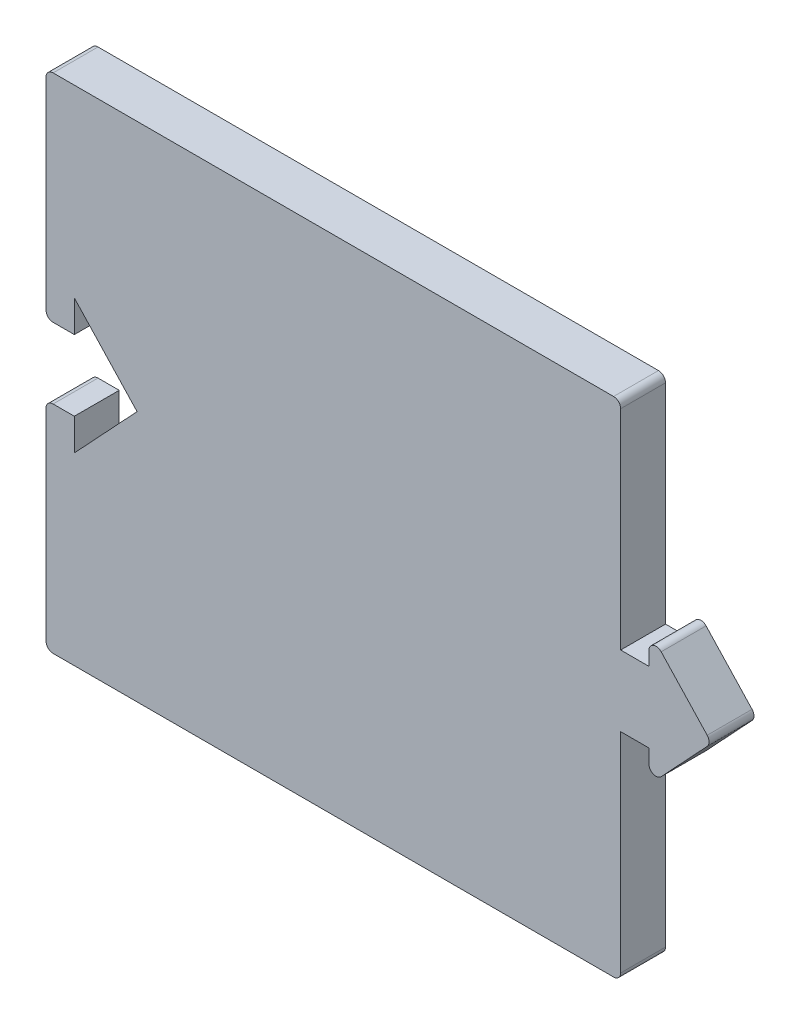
SolidWorks part; units mm, degrees
ref_plane "Front" through (0, 0, 0) normal (0, 0, 1) x (1, 0, 0)
ref_plane "Top" through (0, 0, 0) normal (0, 1, 0) x (1, 0, 0)
ref_plane "Right" through (0, 0, 0) normal (1, 0, 0) x (0, 0, -1)
sketch "Sketch1" plane through (0, 0, 0) normal (0, 0, 1) x (1, 0, 0)
  line L0 (0, 0) -> (0, 15.28) construction
  line L1 (40.64, 35.56) -> (40.64, 20.28)
  line L2 (40.64, 0) -> (0, 0) construction
  line L3 (0, 35.56) -> (40.64, 35.56) construction
  line L4 (0, 17.78) -> (40.64, 17.78) construction
  line L5 (20.32, 35.56) -> (20.32, 0) construction
  line L6 (0, 35.56) -> (40.64, 35.56)
  line L7 (0, 0) -> (40.64, 0)
  line L8 (40.64, 20.28) -> (42.64, 20.28)
  line L9 (42.64, 20.28) -> (42.64, 22.53)
  line L10 (42.64, 22.53) -> (47.0771, 17.78)
  line L11 (42.64, 13.03) -> (47.0771, 17.78)
  line L12 (42.64, 15.28) -> (42.64, 13.03)
  line L13 (40.64, 15.28) -> (42.64, 15.28)
  line L14 (0, 20.28) -> (2, 20.28)
  line L15 (2, 20.28) -> (2, 22.53)
  line L16 (0, 35.56) -> (0, 20.28)
  line L17 (0, 20.28) -> (0, 35.56) construction
  line L18 (0, 15.28) -> (0, 0)
  line L19 (2, 22.53) -> (6.4371, 17.78)
  line L20 (2, 13.03) -> (6.4371, 17.78)
  line L21 (40.64, 15.28) -> (40.64, 0)
  line L22 (2, 15.28) -> (2, 13.03)
  line L23 (0, 15.28) -> (2, 15.28)
  dimension "D10" = 6.5
  dimension "D1" = 35.56
  dimension "D2" = 2
  dimension "D3" = 40.64
  dimension "D4" = 6.5
  dimension "D5" = 2.5
  dimension "D6" = 2.25
  dimension "D7" = 2
  dimension "D8" = 2.25
  dimension "D11" = 2.5
extrude "Boss-Extrude1" add sketch "Sketch1" along normal blind 3.175
sketch "Sketch2" plane through (0, 0, 3.175) normal (0, 0, 1) x (1, 0, 0)
  line L1 (10.5865, 4.4677) -> (35.9865, 4.4677)
  line L2 (10.5865, 4.4677) -> (10.5865, 29.8677)
  line L3 (10.5865, 29.8677) -> (35.9865, 29.8677)
  line L4 (35.9865, 4.4677) -> (35.9865, 29.8677)
  dimension "D1" = 25.4
extrude "Cut-Extrude1" [suppressed] cut sketch "Sketch2" against normal blind 1
fillet "Fillet1" radius 0.5 9 edges at (42.64, 13.03, 1.5875) (42.64, 22.53, 1.5875) (47.0771, 17.78, 1.5875) (40.64, 0, 1.5875) (0, 0, 1.5875) (0, 15.28, 1.5875) (0, 20.28, 1.5875) (40.64, 35.56, 1.5875) (0, 35.56, 1.5875)
